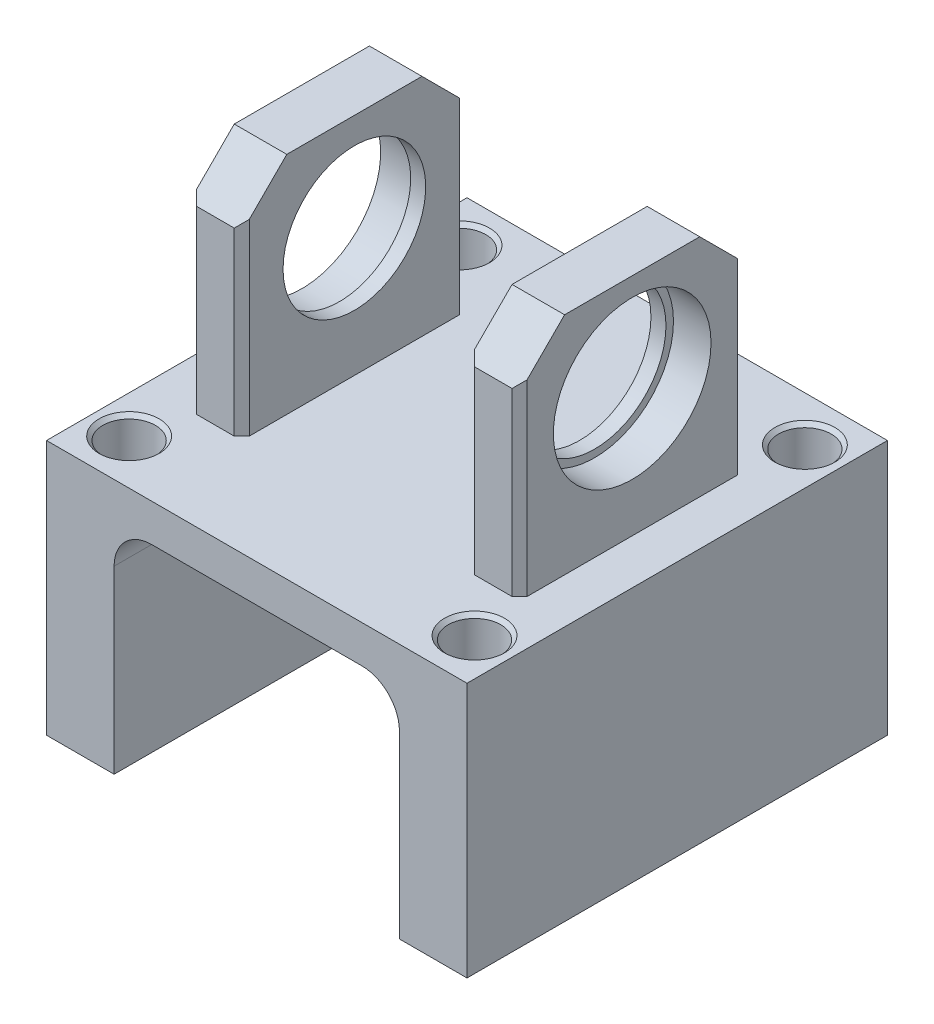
SolidWorks part; units mm, degrees
ref_plane "Спереди" through (0, 0, 0) normal (0, 0, 1) x (1, 0, 0)
ref_plane "Сверху" through (0, 0, 0) normal (0, 1, 0) x (1, 0, 0)
ref_plane "Справа" through (0, 0, 0) normal (1, 0, 0) x (0, 0, -1)
sketch "Эскиз1" plane through (0, 0, 0) normal (0, 1, 0) x (1, 0, 0)
  line L1 (-28, 28) -> (28, 28)
  line L2 (-28, 28) -> (-28, -28)
  line L3 (-28, -28) -> (28, -28)
  line L4 (28, 28) -> (28, -28)
  line L5 (-28, 28) -> (28, -28) construction
  line L6 (-28, -28) -> (28, 28) construction
  point P0 (0, 0)
  dimension "D1" = 56
  dimension "D2" = 56
extrude "Бобышка-Вытянуть1" add sketch "Эскиз1" along normal blind 34
sketch "Эскиз2" plane through (0, 0, 0) normal (0, 0, 1) x (1, 0, 0)
  line L0 (-28, 0) -> (28, 0) construction
  line L1 (-19, 0) -> (19, 0)
  line L2 (-19, 0) -> (-19, 24)
  line L3 (-14, 29) -> (14, 29)
  line L4 (19, 0) -> (19, 24)
  line L5 (-28, 34) -> (28, 34) construction
  arc A0 (19, 24) -> (14, 29) centre (14, 24) ccw
  arc A1 (-19, 24) -> (-14, 29) centre (-14, 24) cw
  point P12 (19, 29)
  point P15 (-19, 29)
  dimension "D4" = 5
  dimension "D1" = 38
  dimension "D2" = 19
  dimension "D3" = 5
extrude "Вырез-Вытянуть1" cut sketch "Эскиз2" against normal through all both and the other way through all
sketch "Эскиз3" plane through (0, 34, 0) normal (0, 1, 0) x (1, 0, 0)
  line L0 (28, 28) -> (-28, 28) construction
  line L1 (-22, 15) -> (-15, 15)
  line L2 (-22, 15) -> (-22, -15)
  line L3 (-22, -15) -> (-15, -15)
  line L4 (-15, 15) -> (-15, -15)
  line L5 (-28, 28) -> (-28, -28) construction
  line L6 (0, 0) -> (0, 28) construction
  line L7 (15, 15) -> (15, -15)
  line L8 (22, -15) -> (15, -15)
  line L9 (22, 15) -> (22, -15)
  line L10 (22, 15) -> (15, 15)
  dimension "D1" = 30
  dimension "D2" = 7
  dimension "D3" = 13
  dimension "D4" = 6
  dimension "D5" = 30
extrude "Бобышка-Вытянуть2" add sketch "Эскиз3" along normal blind 30
chamfer "Chanfrein1" distance 6 angle 45 4 edges at (-18.5, 64, -15) (-18.5, 64, 15) (18.5, 64, 15) (18.5, 64, -15)
chamfer "Фаска1" distance 1 angle 45 8 edges at (-22, 46, -15) (-15, 46, -15) (15, 46, -15) (22, 46, -15) (22, 46, 15) (15, 46, 15) (-15, 46, 15) (-22, 46, 15)
sketch "Эскиз4" plane through (22, 0, 0) normal (1, 0, 0) x (0, 0, -1)
  line L1 (15, 58) -> (15, 34) construction
  line L2 (14, 34) -> (-14, 34) construction
  circle A0 centre (0, 51) radius 10.5
  dimension "D1" = 17
  dimension "D2" = 15
  dimension "D3" = 21
extrude "Вырез-Вытянуть2" cut sketch "Эскиз4" against normal blind 5
sketch "Эскиз5" plane through (17, 0, 0) normal (1, 0, 0) x (0, 0, -1)
  circle A0 centre (0, 51) radius 9.5
  point P3 (0, 0)
  dimension "D1" = 19
extrude "Вырез-Вытянуть3" cut sketch "Эскиз5" against normal through all
sketch "Эскиз6" plane through (-22, 0, 0) normal (-1, 0, 0) x (0, 0, 1)
  circle A0 centre (0, 51) radius 10.5
  dimension "D1" = 21
extrude "Вырез-Вытянуть6" cut sketch "Эскиз6" against normal blind 5 contours A0
sketch "Эскиз7" plane through (0, 0, 0) normal (0, -1, 0) x (1, 0, 0)
  line L0 (1.4122, 0) -> (29.4122, 0) construction
  line L2 (0, 0) -> (0, 17.631) construction
  circle A0 centre (-23, 22) radius 2.5
  circle A1 centre (-23, -22) radius 2.5
  circle A2 centre (23, -22) radius 2.5
  circle A3 centre (23, 22) radius 2.5
  dimension "D1" = 5
  dimension "D2" = 22
  dimension "D3" = 23
extrude "Вырез-Вытянуть7" cut sketch "Эскиз7" against normal blind 10
sketch "Эскиз8" plane through (0, 34, 0) normal (0, 1, 0) x (1, 0, 0)
  circle A0 centre (-23, 22) radius 3.5
  circle A1 centre (-23, -22) radius 3.5
  circle A2 centre (23, 22) radius 3.5
  circle A3 centre (23, -22) radius 3.5
extrude "Вырез-Вытянуть8" cut sketch "Эскиз8" against normal blind 15
chamfer "Фаска2" distance 0.5 angle 45 8 edges at (-23, 0, 19.5) (23, 0, 24.5) (23, 0, -24.5) (-23, 0, -19.5) (-23, 34, 25.5) (23, 34, 25.5) (-23, 34, -18.5) (23, 34, -18.5)
sketch "Эскиз10" plane through (0, 34, 0) normal (0, 1, 0) x (1, 0, 0)
  point P0 (3.8964, 21.005)
  point P1 (13.5964, 21.005)
hole_wizard "Цековка для  болта с шестигранной головкой M52" positions "Эскиз14" profile "Эскиз15" counterbore size "M5" standard "Ansi Metric"
sketch "Эскиз14" plane through (0, 29, 0) normal (0, -1, 0) x (-1, 0, 0)
  point P0 (-13.6844, 20.6514)
  point P2 (-3.8731, 20.6514)
sketch "Эскиз15" plane through (13.6844, 29, -20.6514) normal (1, 0, 0) x (0, 0, -1)
  line L0 (0, 0) -> (0, 35)
  line L1 (0, 35) -> (1.6, 35)
  line L3 (1.6, 35) -> (1.6, 4)
  line L4 (1.6, 4) -> (2.75, 4)
  line L5 (2.75, 4) -> (2.75, 0)
  line L7 (2.75, 0) -> (0, 0)
  line L11 (0, -6.35) -> (0, 107.95) construction
  dimension "Диаметр сквозного отверстия" = 3.2
  dimension "Глубина сквозного отверстия" = 35
  dimension "Диаметр цековки" = 5.5
  dimension "Глубина цековки" = 4
